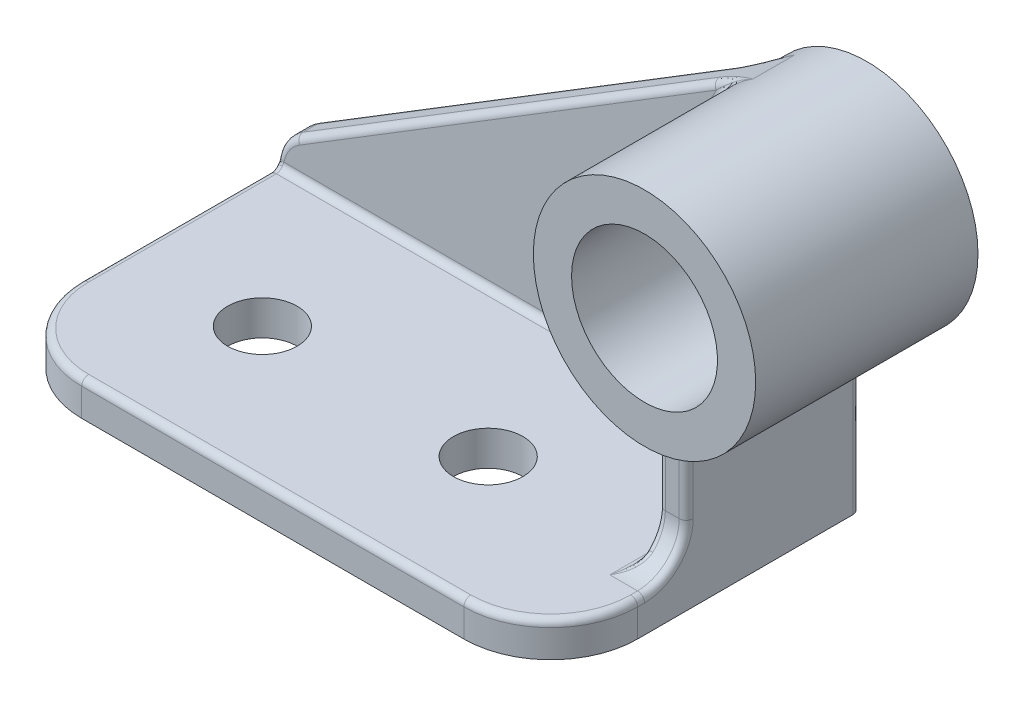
SolidWorks part; units mm, degrees
ref_plane "Front" through (0, 0, 0) normal (0, 0, 1) x (1, 0, 0)
ref_plane "Top" through (0, 0, 0) normal (0, 1, 0) x (1, 0, 0)
ref_plane "Right" through (0, 0, 0) normal (1, 0, 0) x (0, 0, -1)
sketch "Sketch1" plane through (0, 0, 0) normal (0, 1, 0) x (1, 0, 0)
  line L0 (25, 0) -> (135, 0)
  line L1 (0, 25) -> (0, 89)
  line L2 (160, 89) -> (0, 89)
  line L3 (160, 89) -> (160, 25)
  arc A0 (25, 0) -> (0, 25) centre (25, 25) cw
  arc A1 (160, 25) -> (135, 0) centre (135, 25) cw
  dimension "D1" = 25
  dimension "D2" = 25
  dimension "D3" = 89
  dimension "D4" = 160
extrude "Base-Extrude" add sketch "Sketch1" along normal blind 10
sketch "Sketch2" plane through (0, 0, -89) normal (0, 0, -1) x (-1, 0, 0)
  line L0 (-160, 0) -> (0, 0) construction
  line L1 (0, 10) -> (0, 0) construction
  line L2 (-160, 10) -> (0, 10) construction
  line L3 (-160, 10) -> (0, 10)
  line L4 (-160, 10) -> (-160, 0) construction
  line L5 (-160, 10) -> (-160, 43.251)
  line L6 (-5.7182, 20.2244) -> (-139.2484, 102.2651)
  arc A0 (-139.2484, 102.2651) -> (-160, 43.251) centre (-156, 75) ccw
  arc A1 (0, 10) -> (-5.7182, 20.2244) centre (-12, 10) ccw
  dimension "D1" = 64
  dimension "D4" = 12
  dimension "D2" = 75
  dimension "D3" = 156
extrude "Boss-Extrude1" add sketch "Sketch2" against normal blind 8
ref_plane "Plane4" through (0, 0, -95) normal (0, 0, -1) x (-1, 0, 0)
sketch "Sketch3" plane through (0, 0, -95) normal (0, 0, -1) x (-1, 0, 0)
  circle A0 centre (-156, 75) radius 32
  arc A1 (-139.2484, 102.2651) -> (-160, 43.251) centre (-156, 75) ccw construction
extrude "Boss-Extrude2" add sketch "Sketch3" against normal blind 64
sketch "Sketch7" plane through (0, 0, -95) normal (0, 0, -1) x (-1, 0, 0)
  circle A0 centre (-156, 75) radius 21
  dimension "D1" = 42
extrude "Cut-Extrude1" cut sketch "Sketch7" against normal through all
sketch "Sketch4" plane through (0, 10, 0) normal (0, 1, 0) x (-1, 0, 0)
  line L1 (-152, -81) -> (-152, -25)
  line L2 (-152, -81) -> (-152, -39)
  line L3 (-160, -39) -> (0, -39)
  line L4 (-160, -81) -> (-160, -25) construction
  line L5 (-160, -81) -> (-160, -39)
  line L6 (-160, -81) -> (0, -81) construction
  line L7 (-160, -81) -> (-152, -81)
  line L8 (-160, -39) -> (-152, -39)
  dimension "D1" = 8
  dimension "D2" = 50
extrude "Boss-Extrude3" add sketch "Sketch4" along normal up to next
hole_wizard "Hole1" positions "Sketch5" profile "Sketch6" legacy
sketch "Sketch5" plane through (0, 10, 0) normal (0, 1, 0) x (-1, 0, 0)
  line L0 (0, -25) -> (0, -81) construction
  line L2 (-5.7182, -89) -> (-139.2484, -89) construction
  point P0 (-38, -39)
  dimension "D1" = 38
  dimension "D2" = 50
sketch "Sketch6" plane through (38, 10, -39) normal (1, 0, 0) x (0, 0, 1)
  line L0 (0, 0) -> (0, 10)
  line L1 (0, 10) -> (10, 10)
  line L2 (10, 10) -> (10, 0)
  line L3 (10, 0) -> (0, 0)
pattern_linear "LPattern1" count 2 spacing 65 along (1, 0, 0) of "Hole1"
fillet "Fillet1" radius 12 1 edges at (156, 10, -39)
fillet "Fillet2" radius 2 9 edges at (124.7218, 68.2415, -81) (160, 21.6255, -89) (125.812, 64.3847, -89) (160, 43.251, -64) (156, 43, -39) (152, 43.251, -60) (152, 10, -54) (152, 26.6255, -81)
fillet "Fillet3" radius 2 22 edges at (151.7176, 42.5582, -38.5394) (151.7514, 11.0343, -31.8738) (152, 16.3255, -37.5735) (0, 5, -89) (1.5266, 15.8574, -89) (132.8674, 98.3446, -89.3535) (160.2824, 42.5582, -38.5394) (160, 31.6181, -39) (160, 13.5147, -35.4853) (152.6777, 10, -7.3223) (80, 10, 0) (7.3223, 10, -7.3223) (0.008, 10.438, -80.2491) (132.8674, 98.3446, -80.6465) (152, 31.6181, -39) (67.5887, 58.2375, -89) (67.5887, 58.2375, -81)
